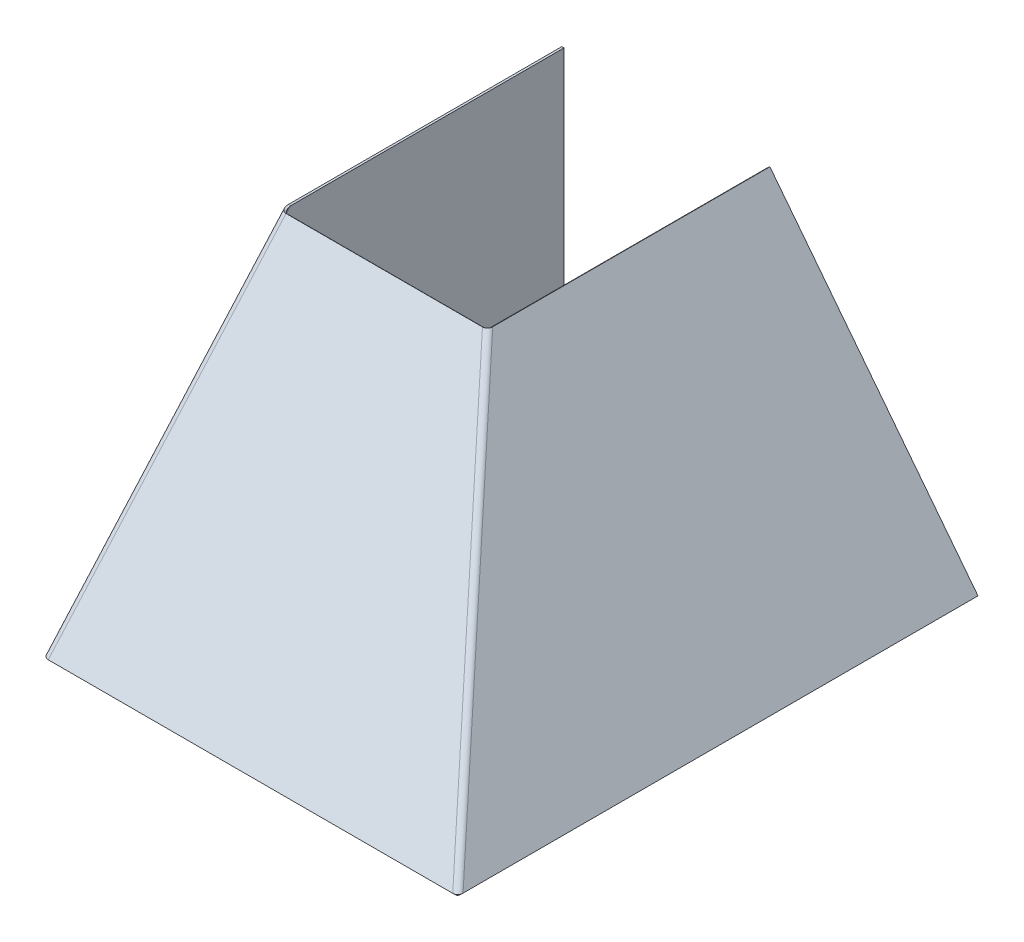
SolidWorks part; units mm, degrees
ref_plane "Plan de face" through (0, 0, 0) normal (0, 0, 1) x (1, 0, 0)
ref_plane "Plan de dessus" through (0, 0, 0) normal (0, 1, 0) x (1, 0, 0)
ref_plane "Plan de droite" through (0, 0, 0) normal (1, 0, 0) x (0, 0, -1)
sketch "Esquisse1" plane through (0, 0, 0) normal (0, 1, 0) x (1, 0, 0)
  line L0 (0, 350) -> (0, 0)
  line L1 (0, 0) -> (280, 0)
  line L2 (280, 0) -> (280, 350)
  dimension "D1" = 280
  dimension "D2" = 350
  dimension "D3" = 350
ref_plane "Plan1" through (0, 180, 0) normal (0, 1, 0) x (1, 0, 0)
sketch "Esquisse2" plane through (0, 180, 0) normal (0, 1, 0) x (1, 0, 0)
  line L0 (0, 350) -> (0, 160)
  line L1 (0, 350) -> (0, 0) construction
  line L2 (0, 160) -> (140, 160)
  line L3 (140, 160) -> (140, 350)
  dimension "D1" = 190
  dimension "D2" = 190
  dimension "D3" = 140
lofted bend "Plis de transition1" thickness 1.5 parameters "D1"=0, "D13"=0.5, "D15"=5, "D16"=30
bend "Pli issu d'un arrondi1" bend radius 3 bend angle 90 parameters "D5"=1
bend "Pli issu d'un arrondi2" bend radius 3 bend angle 65.928 parameters "D5"=2
sketch "Lignes de pliage1" plane through (0, 0, 0) normal (0, 1, 0) x (1, 0, 0)
sketch "Cube de visualisation1" plane through (0, 0, 0) normal (0, 1, 0) x (1, 0, 0)
sheet metal parameters "Tôlerie1" thickness 1.5 parameters "D1"=1.95
flat pattern "Etat déplié1"
sketch "Lignes de pliage2" plane through (0, 0, 0) normal (0, 1, 0) x (1, 0, 0)
sketch "Cube de visualisation2" [suppressed] plane through (0, 0, 0) normal (0, 1, 0) x (1, 0, 0)
bend of the flat pattern "Dépliage-<Pli issu d'un arrondi1>1"
bend of the flat pattern "Dépliage-<Pli issu d'un arrondi2>1"
